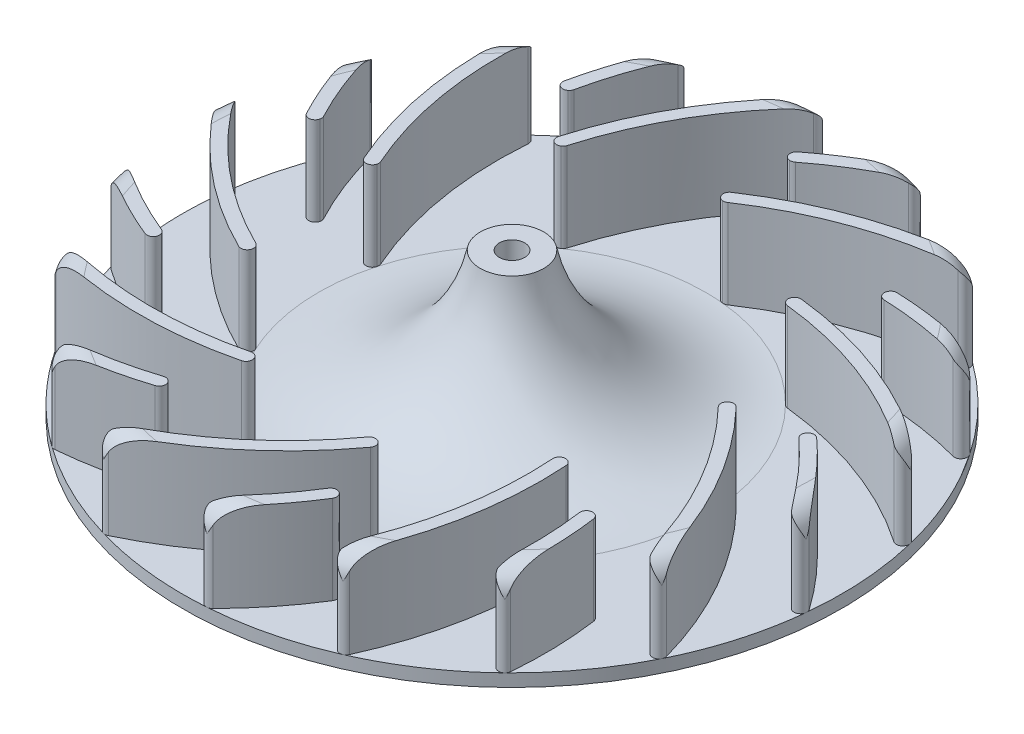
SolidWorks part; units mm, degrees
ref_plane "Face" through (0, 0, 0) normal (0, 0, 1) x (1, 0, 0)
ref_plane "Dessus" through (0, 0, 0) normal (0, 1, 0) x (1, 0, 0)
ref_plane "Droite" through (0, 0, 0) normal (1, 0, 0) x (0, 0, -1)
sketch "Esquisse1" plane through (0, 0, 0) normal (0, 0, 1) x (1, 0, 0)
  line L0 (0, 0) -> (0, 10.5) construction
  line L1 (1, 2) -> (1, 10.5)
  line L2 (1, 10.5) -> (2.5, 10.5)
  line L3 (15.2574, 0) -> (26, 0)
  arc A0 (2.5, 10.5) -> (15.2574, 0) centre (15.2574, 13) ccw
  dimension "D5" = 13
  dimension "D1" = 10.5
  dimension "D2" = 2
  dimension "D3" = 2
  dimension "D4" = 52
  dimension "D6" = 5
revolve "Cône" add sketch "Esquisse1" angle 360 about L0
sketch "Esquisse2" plane through (0, 0, 0) normal (0, 0, 1) x (1, 0, 0)
  line L1 (1, 2) -> (1, 10.5) construction
  line L2 (1, 3) -> (5.4594, 3)
  line L3 (-2, 2) -> (2, 2) construction
  line L4 (1, 3) -> (1, 8.5008)
  line L5 (2, 8.5008) -> (-2, 8.5008) construction
  line L6 (2, 8.5008) -> (1, 8.5008)
  arc A0 (2, 8.5008) -> (15.2574, -1) centre (15.2574, 13) ccw construction
  arc A1 (2, 8.5008) -> (5.4594, 3) centre (15.2574, 13) ccw
  dimension "D1" = 1
extrude "Nervure" add sketch "Esquisse2" along normal mid plane 1
pattern_circular "Répétition nervure" count 4 over 360 about axis through (0, 0, 0) along (0, 1, 0)
sketch "Esquisse4" plane through (0, 0, 0) normal (0, 1, 0) x (-1, 0, 0)
  line L0 (0, -15.2574) -> (0, -26) construction
  arc A0 (0, -15.2574) -> (-15.2238, -21.0769) centre (-17.9212, 8.8016) cw
  circle A1 centre (0, 0) radius 15.2574 construction
  circle A2 centre (0, 0) radius 26 construction
  arc A3 (-1.6045, -15.1727) -> (-16.4193, -20.1595) centre (-17.9212, 8.8016) cw
  arc A4 (-16.4193, -20.1595) -> (-15.2238, -21.0769) centre (0, 0) ccw
  arc A5 (-1.6045, -15.1727) -> (0, -15.2574) centre (0, 0) ccw
  dimension "D2" = 30
  dimension "D1" = 16
  dimension "D3" = 1
extrude "Pale" add sketch "Esquisse4" along normal blind 7
sketch "Esquisse5" plane through (0, 0, 0) normal (0, 1, 0) x (-1, 0, 0)
  line L0 (0, -15.2574) -> (0, -26) construction
  arc A0 (0, -20.6287) -> (-6.9363, -25.0577) centre (-19.4608, 2.2029) cw
  circle A1 centre (0, 0) radius 26 construction
  arc A18 (-1.5096, -20.5734) -> (-8.401, -24.6054) centre (-19.4608, 2.2029) cw
  arc A19 (-8.401, -24.6054) -> (-6.9363, -25.0577) centre (0, 0) ccw
  arc A20 (-1.5096, -20.5734) -> (0, -20.6287) centre (0, 0) ccw
  arc A21 (-15.2238, -21.0769) -> (-16.4193, -20.1595) centre (0, 0) ccw construction
  dimension "D2" = 30
  dimension "D3" = 7
  dimension "D1" = 1
extrude "Demi pale" add sketch "Esquisse5" along normal blind 7
fillet "Congé pale" radius 0.5
pattern_circular "Répétition pales" count 9 over 360 about axis through (0, 0, 0) along (0, 1, 0)
sketch "Esquisse6" plane through (0, 0, 0) normal (0, 0, 1) x (1, 0, 0)
  line L0 (26, 3) -> (26, 5)
  line L1 (24, 7) -> (22, 7)
  line L2 (22, 7) -> (22, 8)
  line L3 (22, 8) -> (27, 8)
  line L4 (27, 8) -> (27, 3)
  line L5 (27, 3) -> (26, 3)
  line L6 (0, -1) -> (0, 10.5) construction
  line L9 (26, -1) -> (26, 0) construction
  line L10 (-26, -1) -> (26, -1) construction
  arc A0 (26, 5) -> (24, 7) centre (24, 5) ccw
  dimension "D6" = 2
  dimension "D1" = 8
  dimension "D2" = 1
  dimension "D3" = 1
  dimension "D4" = 5
  dimension "D5" = 5
revolve "Arrondi radial" cut sketch "Esquisse6" angle 360 about L6
